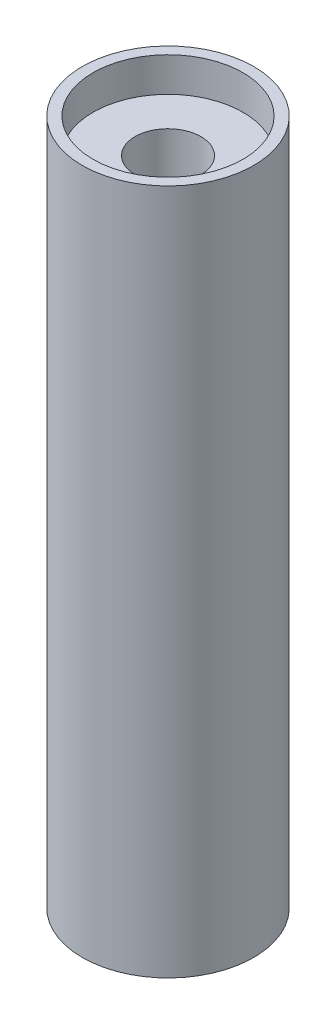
SolidWorks part; units mm, degrees
ref_plane "Front Plane" through (0, 0, 0) normal (0, 0, 1) x (1, 0, 0)
ref_plane "Top Plane" through (0, 0, 0) normal (0, 1, 0) x (1, 0, 0)
ref_plane "Right Plane" through (0, 0, 0) normal (1, 0, 0) x (0, 0, -1)
sketch "Sketch1" plane through (0, 0, 0) normal (0, 1, 0) x (1, 0, 0)
  circle A0 centre (0, 0) radius 3.175
  dimension "D1" = 6.35
extrude "Boss-Extrude1" add sketch "Sketch1" along normal blind 25.4
hole_wizard "CBORE for #00 Binding Head Machine Screw1" positions "Sketch3" profile "Sketch5" counterbore size "#00" standard "ANSI Inch"
sketch "Sketch3" plane through (0, 0, 0) normal (0, -1, 0) x (-1, 0, 0)
  point P0 (0, 0)
sketch "Sketch5" plane through (0, 0, 0) normal (1, 0, 0) x (0, 0, -1)
  line L0 (0, 0) -> (0, 6.7697)
  line L1 (0, 6.7697) -> (0.6985, 6.35)
  line L2 (0.6985, 6.35) -> (0.6985, 0.7112)
  line L3 (0.6985, 0.7112) -> (1.5875, 0.7112)
  line L4 (1.5875, 0.7112) -> (1.5875, 0)
  line L5 (1.5875, 0) -> (0, 0)
  line L10 (0, 6.7697) -> (-0.6985, 6.35) construction
  line L11 (0, -6.35) -> (0, 107.95) construction
  dimension "Hole Dia." = 1.397
  dimension "Hole Depth" = 6.35
  dimension "C'Bore Dia." = 3.175
  dimension "C'Bore Depth" = 0.7112
  dimension "Drill Angle" = 118
sketch "Sketch6" plane through (0, 25.4, 0) normal (0, 1, 0) x (1, 0, 0)
  circle A0 centre (0, 0) radius 0.9373
  point P0 (0, 0)
hole_wizard "CBORE for #2 Binding Head Machine Screw1" positions "Sketch6" profile "Sketch7" counterbore size "#2" standard "ANSI Inch"
sketch "Sketch7" plane through (0, 25.4, 0) normal (1, 0, 0) x (0, 0, 1)
  line L0 (0, 0) -> (0, 7.0826)
  line L1 (0, 7.0826) -> (1.2192, 6.35)
  line L2 (1.2192, 6.35) -> (1.2192, 1.27)
  line L3 (1.2192, 1.27) -> (2.7788, 1.27)
  line L4 (2.7788, 1.27) -> (2.7788, 0)
  line L5 (2.7788, 0) -> (0, 0)
  line L10 (0, 7.0826) -> (-1.2192, 6.35) construction
  line L11 (0, -6.35) -> (0, 107.95) construction
  dimension "Hole Dia." = 2.4384
  dimension "Hole Depth" = 6.35
  dimension "C'Bore Dia." = 5.5575
  dimension "C'Bore Depth" = 1.27
  dimension "Drill Angle" = 118
